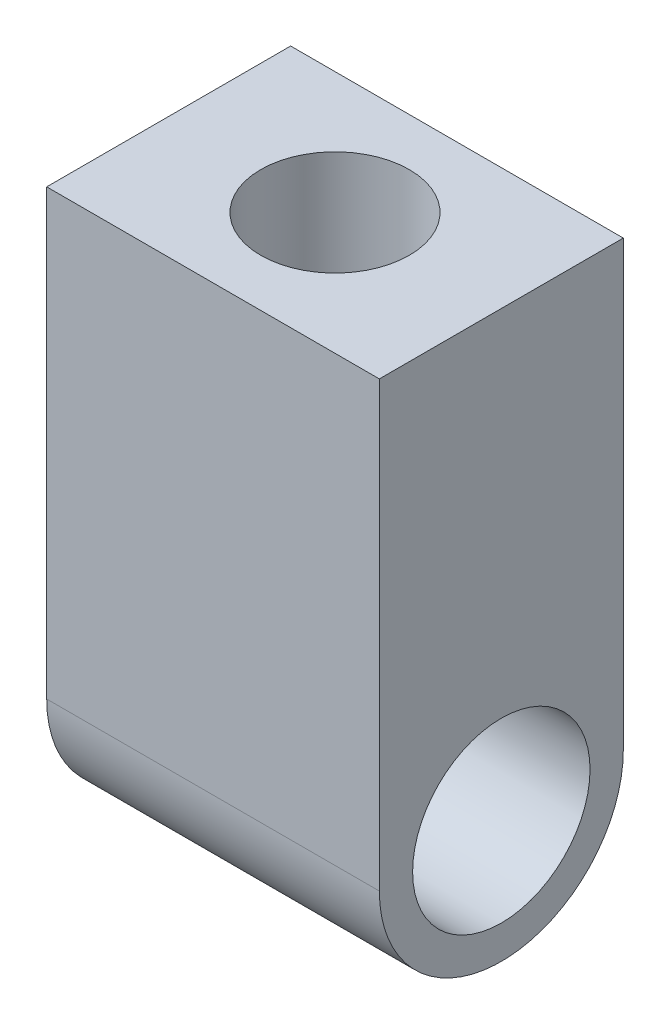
SolidWorks part; units mm, degrees
ref_plane "Front Plane" through (0, 0, 0) normal (0, 0, 1) x (1, 0, 0)
ref_plane "Top Plane" through (0, 0, 0) normal (0, 1, 0) x (1, 0, 0)
ref_plane "Right Plane" through (0, 0, 0) normal (1, 0, 0) x (0, 0, -1)
sketch "Sketch1" plane through (0, 0, 0) normal (1, 0, 0) x (0, 0, -1)
  line L0 (-5.5, 0) -> (-5.5, 20)
  line L1 (-5.5, 20) -> (5.5, 20)
  line L2 (5.5, 20) -> (5.5, 0)
  circle A0 centre (0, 0) radius 4
  arc A1 (-5.5, 0) -> (5.5, 0) centre (0, 0) ccw
extrude "Boss-Extrude1" add sketch "Sketch1" along normal mid plane 15
sketch "Sketch2" plane through (0, 20, 0) normal (0, 1, 0) x (1, 0, 0)
  circle A0 centre (0, 0) radius 3.35
extrude "Cut-Extrude1" cut sketch "Sketch2" against normal blind 14
